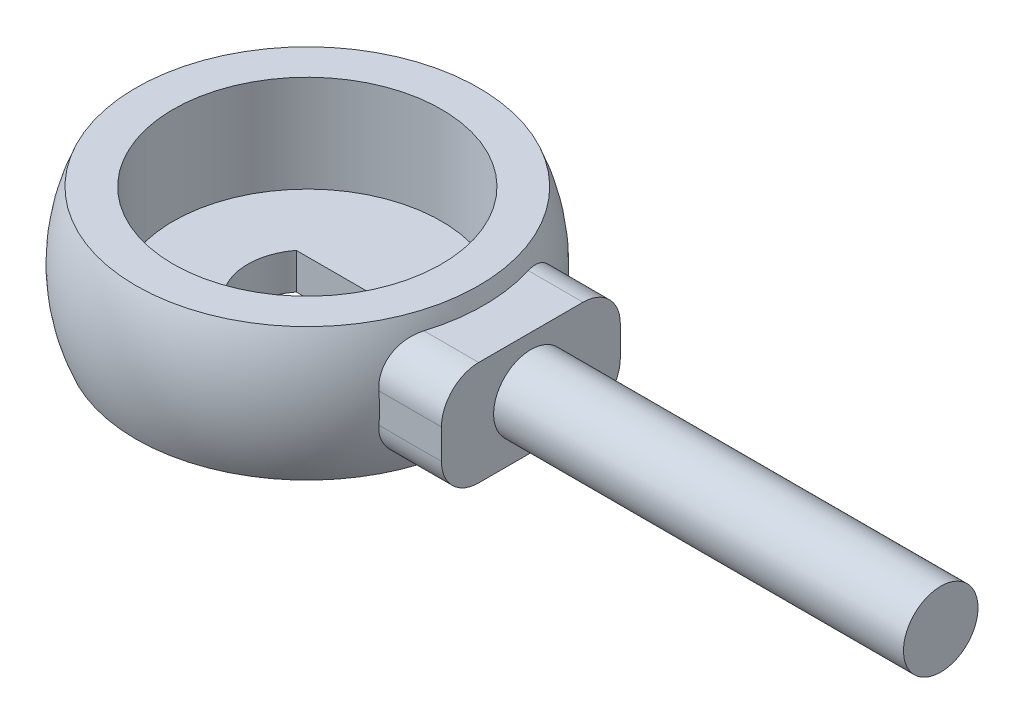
SolidWorks part; units mm, degrees
ref_plane "Front" through (0, 0, 0) normal (0, 0, 1) x (1, 0, 0)
ref_plane "Top" through (0, 0, 0) normal (0, 1, 0) x (1, 0, 0)
ref_plane "Right" through (0, 0, 0) normal (1, 0, 0) x (0, 0, -1)
sketch "Sketch1" plane through (0, 0, 0) normal (0, 0, 1) x (1, 0, 0)
  line L0 (0, 8.9196) -> (0, -8.9196)
  line L1 (0, 8.9196) -> (23, 8.9196)
  line L2 (0, -8.9196) -> (23, -8.9196)
  arc A0 (23, 8.9196) -> (23, -8.9196) centre (1.8, 0) cw
  dimension "D1" = 23
  dimension "D2" = 23
  dimension "D3" = 1.8
revolve "Revolve1" add sketch "Sketch1" angle 360 about L0
sketch "Sketch3" plane through (0, 8.9196, 0) normal (0, 1, 0) x (1, 0, 0)
  circle A0 centre (0, 0) radius 18
  dimension "D1" = 36
extrude "Cut-Extrude1" cut sketch "Sketch3" against normal blind 13
ref_plane "Plane1" through (30, 0, 0) normal (1, 0, 0) x (0, 0, -1)
sketch "Sketch4" plane through (30, 0, 0) normal (1, 0, 0) x (0, 0, -1)
  line L1 (-12, 7) -> (12, 7)
  line L2 (-12, 7) -> (-12, -7)
  line L3 (-12, -7) -> (12, -7)
  line L4 (12, 7) -> (12, -7)
  line L5 (-12, 7) -> (12, -7) construction
  line L6 (-12, -7) -> (12, 7) construction
  point P0 (0, 0)
  dimension "D1" = 24
  dimension "D2" = 14
extrude "Boss-Extrude1" add sketch "Sketch4" against normal up to next
sketch "Sketch5" plane through (30, 0, 0) normal (1, 0, 0) x (0, 0, -1)
  circle A0 centre (0, 0) radius 5
  dimension "D1" = 10
extrude "Boss-Extrude2" add sketch "Sketch5" along normal blind 55
sketch "Sketch6" plane through (0, -4.0804, 0) normal (0, 1, 0) x (1, 0, 0)
  line L1 (-6.35, 4.866) -> (6.35, 4.866)
  line L3 (-6.35, -4.866) -> (6.35, -4.866)
  line L5 (-6.35, 4.866) -> (6.35, -4.866) construction
  line L6 (-6.35, -4.866) -> (6.35, 4.866) construction
  arc A0 (6.35, 4.866) -> (6.35, -4.866) centre (0, 0) cw
  arc A1 (-6.35, 4.866) -> (-6.35, -4.866) centre (0, 0) ccw
  point P0 (0, 0)
  dimension "D2" = 8
  dimension "D1" = 12.7
extrude "Cut-Extrude2" cut sketch "Sketch6" against normal blind 55
fillet "Fillet1" radius 5 4 edges at (25.2239, -7, -12) (25.2239, 7, -12) (25.2239, -7, 12) (25.2239, 7, 12)
fillet "Fillet2" [suppressed] radius 2
